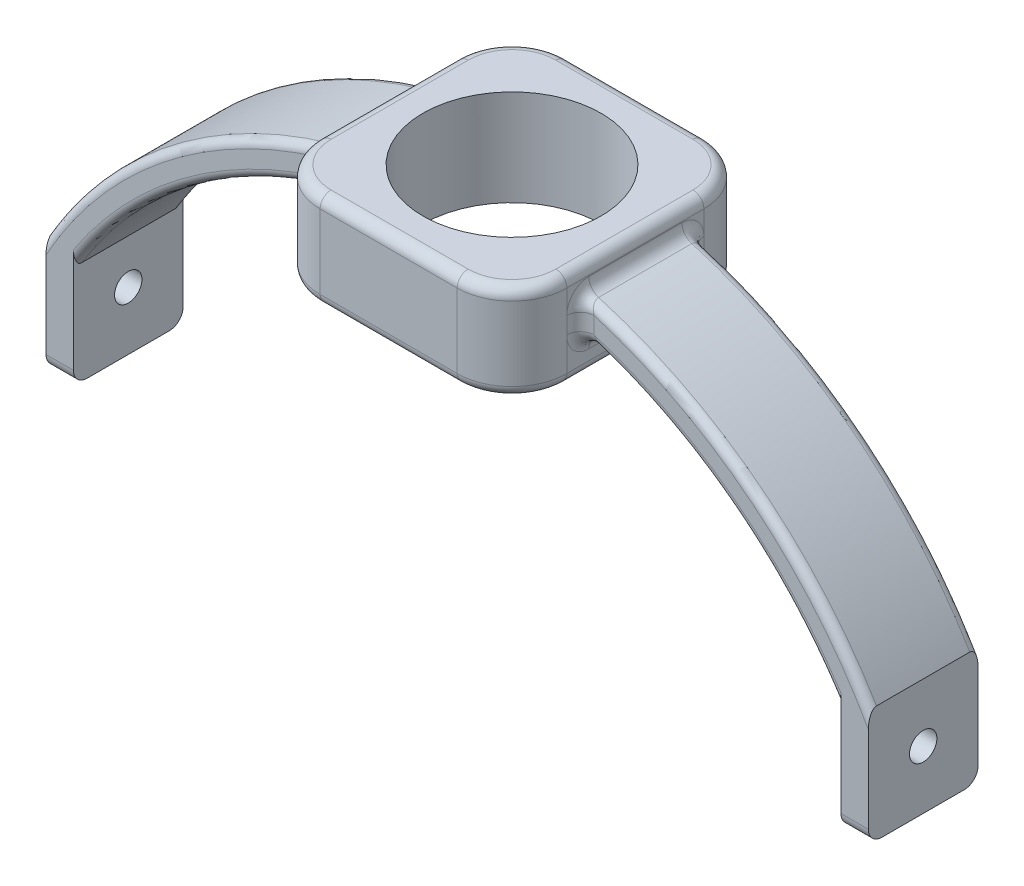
SolidWorks part; units mm, degrees
ref_plane "前视基准面" through (0, 0, 0) normal (0, 0, 1) x (1, 0, 0)
ref_plane "上视基准面" through (0, 0, 0) normal (0, 1, 0) x (1, 0, 0)
ref_plane "右视基准面" through (0, 0, 0) normal (1, 0, 0) x (0, 0, -1)
sketch "草图1" plane through (0, 0, 0) normal (0, 0, 1) x (1, 0, 0)
  line L0 (-43.145, 0) -> (40.7186, 0) construction
  line L1 (-30, 0) -> (-28, 0)
  line L2 (-28, 0) -> (-28, 7.5)
  line L3 (-30, 0) -> (-30, 8.5)
  line L4 (0, 30.6935) -> (0, -10.4849) construction
  line L5 (30, 0) -> (28, 0)
  line L6 (-9, 26) -> (-9, 24.3715)
  line L7 (30, 0) -> (30, 8.5)
  line L8 (9, 20) -> (9, 21.9111)
  line L9 (-9, 26) -> (9, 26)
  line L10 (-9, 21.9111) -> (-9, 20)
  line L11 (-9, 20) -> (9, 20)
  line L12 (9, 24.3715) -> (9, 26)
  line L13 (28, 0) -> (28, 7.5)
  arc A0 (-30, 8.5) -> (-9, 24.3715) centre (0, -9.3652) cw
  arc A1 (-28, 7.5) -> (-9, 21.9111) centre (0, -9.6853) cw
  arc A2 (9, 21.9111) -> (28, 7.5) centre (0, -9.6853) cw
  arc A3 (9, 24.3715) -> (30, 8.5) centre (0, -9.3652) cw
  point P15 (0, 23)
  dimension "D1" = 28
  dimension "D3" = 20
  dimension "D4" = 18
  dimension "D5" = 6
  dimension "D2" = 2
extrude "凸台-拉伸1" add sketch "草图1" along normal mid plane 8
sketch "草图2" plane through (0, 26, 0) normal (0, 1, 0) x (1, 0, 0)
  line L1 (-9, 9) -> (9, 9)
  line L2 (-9, 9) -> (-9, -9)
  line L3 (-9, -9) -> (9, -9)
  line L4 (9, 9) -> (9, -9)
  line L5 (-9, 9) -> (9, -9) construction
  line L6 (-9, -9) -> (9, 9) construction
  point P0 (0, 0)
extrude "凸台-拉伸2" add sketch "草图2" against normal blind 7
fillet "圆角1" radius 4 4 edges at (-9, 22.5, -9) (9, 22.5, -9) (9, 22.5, 9) (-9, 22.5, 9)
fillet "圆角2" radius 0.6 8 edges at (19.8537, 16.4904, 4) (21.0529, 18.4905, 4) (21.0529, 18.4905, -4) (19.8537, 16.4904, -4) (-19.8537, 16.4904, -4) (-21.0529, 18.4905, -4) (-19.8537, 16.4904, 4) (-21.0529, 18.4905, 4)
fillet "圆角3" radius 1 4 edges at (29, 0, 4) (29, 0, -4) (-29, 0, -4) (-29, 0, 4)
fillet "圆角4" radius 1 16 edges at (-9, 22.0391, -3.7641) (-9, 21.9111, 0) (-9, 22.1336, 3.8593) (-9, 23.1423, 4) (-9, 24.2431, 3.7653) (-9, 24.3715, 0) (-9, 24.149, -3.8601) (9, 24.2431, -3.7653) (9, 24.3715, 0) (9, 24.149, 3.8601) (9, 23.1423, 4) (9, 22.0391, 3.7641) (9, 21.9111, 0) (9, 22.1336, -3.8593) (-9, 23.1423, -4) (9, 23.1423, -4)
sketch "草图3" plane through (0, 26, 0) normal (0, 1, 0) x (1, 0, 0)
  circle A0 centre (0, 0) radius 6.5
  dimension "D1" = 13
extrude "切除-拉伸1" cut sketch "草图3" against normal blind 8
sketch "草图4" plane through (30, 0, 0) normal (1, 0, 0) x (0, 0, -1)
  line L0 (0, 8.5) -> (0, 0) construction
  line L1 (-3.4, 8.5) -> (3.4, 8.5) construction
  line L2 (-3, 0) -> (3, 0) construction
  circle A0 centre (0, 4.25) radius 1
  dimension "D1" = 2
extrude "切除-拉伸2" cut sketch "草图4" against normal blind 65
fillet "圆角5" radius 0.8 16 edges at (-7.8284, 19, 7.8284) (-9, 19, 0) (-7.8284, 19, -7.8284) (0, 19, -9) (7.8284, 19, -7.8284) (9, 19, 0) (7.8284, 19, 7.8284) (-7.8284, 26, 7.8284) (-9, 26, 0) (-7.8284, 26, -7.8284) (0, 26, -9) (7.8284, 26, -7.8284) (9, 26, 0) (7.8284, 26, 7.8284) (0, 19, 9) (0, 26, 9)
